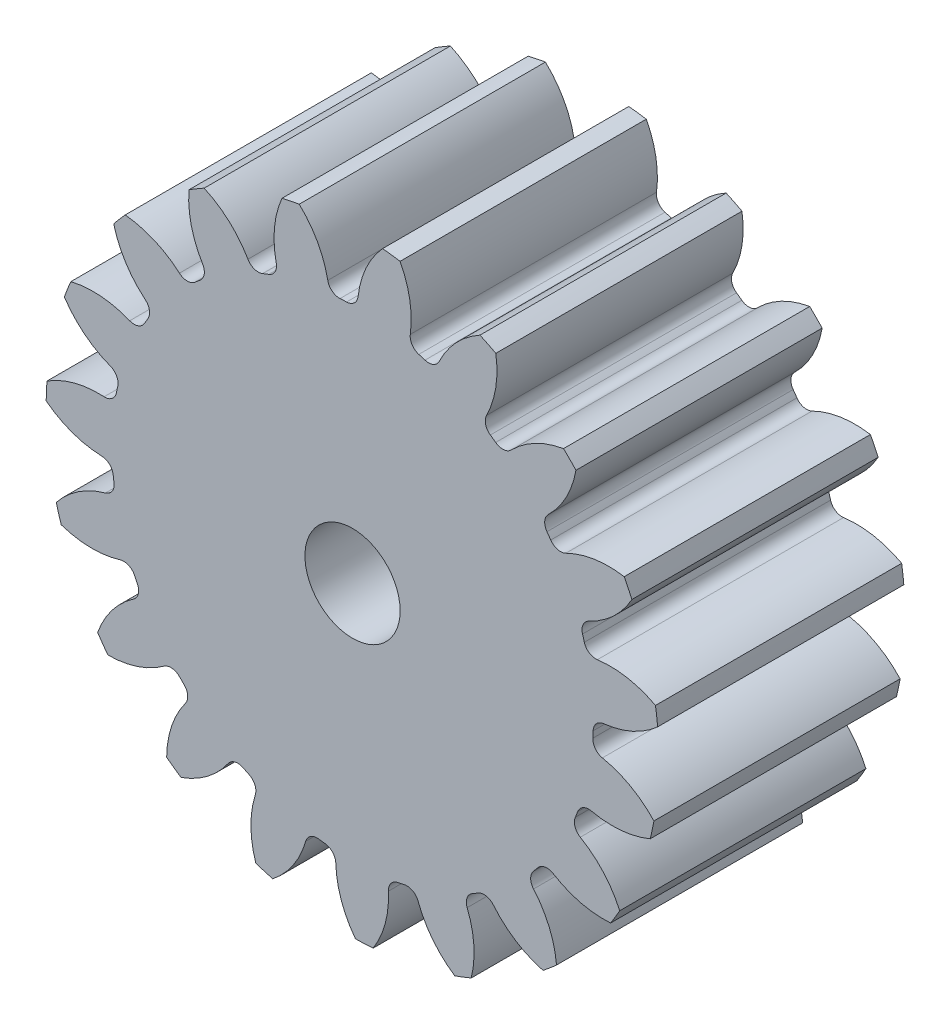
SolidWorks part; units mm, degrees
ref_plane "Front" through (0, 0, 0) normal (0, 0, 1) x (1, 0, 0)
ref_plane "Top" through (0, 0, 0) normal (0, 1, 0) x (1, 0, 0)
ref_plane "Right" through (0, 0, 0) normal (1, 0, 0) x (0, 0, -1)
sketch "Sketch3" plane through (0, 0, 0) normal (0, 0, 1) x (1, 0, 0)
  circle A0 centre (0, 0) radius 118.5333
  dimension "od" = 237.0667
extrude "gearBody" add sketch "Sketch3" along normal blind 95.25
sketch "Sketch2" plane through (0, 0, 0) normal (0, 0, 1) x (1, 0, 0)
  line L0 (0, 0) -> (93.1056, 38.5656) construction
  line L1 (117.0599, -21.8259) -> (0, 0) construction
  line L2 (0, 0) -> (36.3143, 0) construction
  line L3 (107.1664, 4.0905) -> (106.3826, -13.5692) construction
  line L5 (106.7745, -4.7393) -> (0, 0) construction
  line L7 (0, 0) -> (100.7768, 0) construction
  arc A0 (100.7544, 2.1275) -> (100.1696, -11.0458) centre (0, 0) ccw construction
  arc A1 (118.0304, 10.9072) -> (116.5999, -21.3215) centre (0, 0) ccw construction
  arc A2 (107.1664, 4.0905) -> (106.3826, -13.5692) centre (0, 0) ccw construction
  arc A3 (92.9772, -5.3902) -> (93.0891, -2.8686) centre (0, 0) ccw
  arc A4 (117.0599, -21.8259) -> (96.6588, -10.1606) centre (89.3227, -46.6629) ccw
  arc A5 (117.0599, -21.8259) -> (118.5333, 11.3688) centre (0, 0) ccw
  arc A6 (118.5333, 11.3688) -> (97.1789, 1.5569) centre (93.1056, 38.5656) cw
  arc A7 (93.0891, -2.8686) -> (97.1789, 1.5569) centre (97.6815, -3.0101) cw
  arc A8 (96.6588, -10.1606) -> (92.9772, -5.3902) centre (97.5641, -5.6561) cw
  point P6 (118.5333, 11.3688)
  point P22 (117.0599, -21.8259)
  dimension "baseDia" = 201.5536
  dimension "od" = 237.0667
  dimension "pd" = 214.4889
  dimension "rd" = 186.2667
  dimension "rFillet" = 4.5946
  dimension "pointX" = 118.5333
  dimension "pointY" = 11.3688
  dimension "CTT" = 17.6597
  dimension "flankCenterAngle" = 22.5
extrude "toothCut" cut sketch "Sketch2" along normal through all
pattern_circular "CirPattern1" count 19 over 360 about axis through (0, 0, 0) along (0, 0, 1) of "toothCut"
sketch "hub1Dia" plane through (0, 0, 0) normal (0, 0, -1) x (-1, 0, 0)
  circle A0 centre (0, 0) radius 12.7
  dimension "hub1Dia" = 25.4
sketch "hub2Dia" plane through (0, 0, 95.25) normal (0, 0, 1) x (1, 0, 0)
  circle A0 centre (0, 0) radius 12.7
  dimension "hub2dia" = 25.4
sketch "boreDia" plane through (0, 0, 0) normal (0, 0, 1) x (1, 0, 0)
  circle A0 centre (0, 0) radius 18.415
  dimension "boreDia" = 36.83
extrude "bore" cut sketch "boreDia" against normal mid plane 25400
